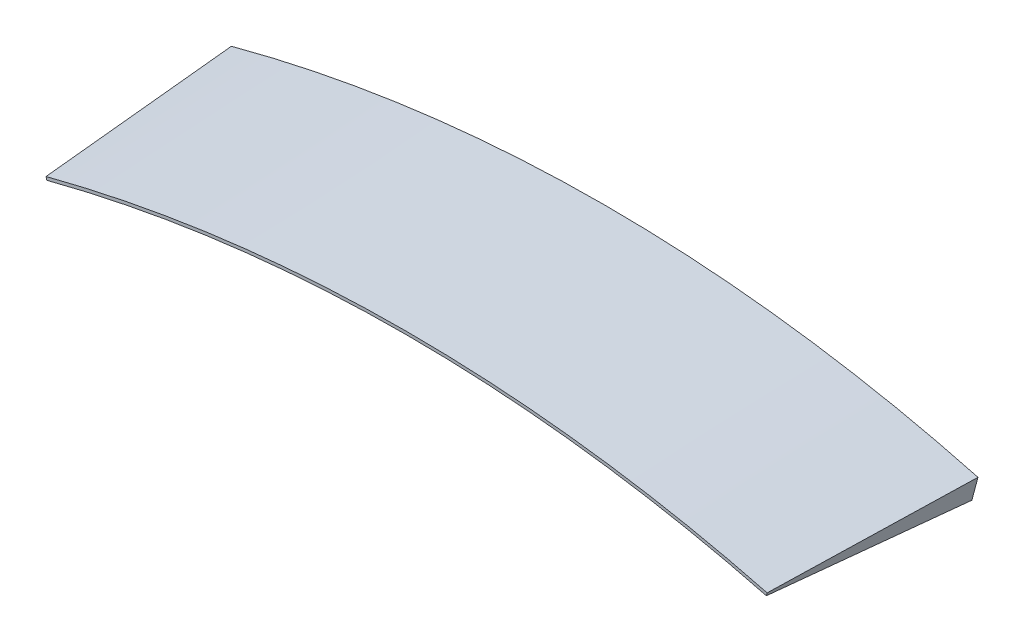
SolidWorks part; units mm, degrees
ref_plane "Plan de face" through (0, 0, 0) normal (0, 0, 1) x (1, 0, 0)
ref_plane "Plan de dessus" through (0, 0, 0) normal (0, 1, 0) x (1, 0, 0)
ref_plane "Plan de droite" through (0, 0, 0) normal (1, 0, 0) x (0, 0, -1)
sketch "Esquisse1" plane through (0, 0, 0) normal (0, 0, 1) x (1, 0, 0)
  line L0 (0, 0) -> (47.1051, 175.7985) construction
  line L1 (0, 0) -> (0, 197.4904) construction
  line L2 (-47.1051, 175.7985) -> (0, 0) construction
  arc A0 (-47.1051, 175.7985) -> (47.1051, 175.7985) centre (0, 0) cw
  dimension "D2" = 182
  dimension "D1" = 30
  dimension "D3" = 15
extrude "Extru.-Mince1" add sketch "Esquisse1" along normal blind 25 draft 3 thin
